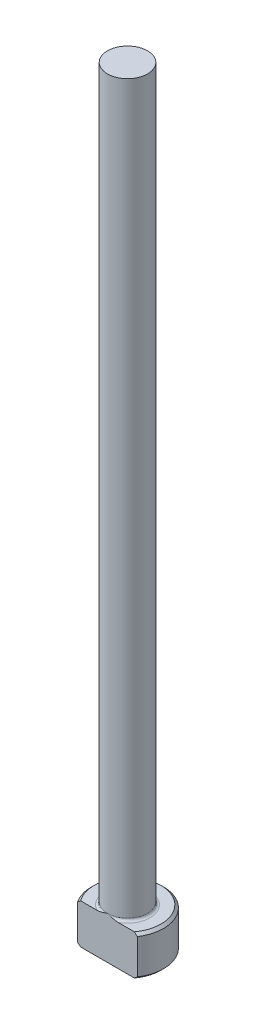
SolidWorks part; units mm, degrees
ref_plane "Front Plane" through (0, 0, 0) normal (0, 0, 1) x (1, 0, 0)
ref_plane "Top Plane" through (0, 0, 0) normal (0, 1, 0) x (1, 0, 0)
ref_plane "Right Plane" through (0, 0, 0) normal (1, 0, 0) x (0, 0, -1)
sketch "Sketch1" plane through (0, 0, 0) normal (0, 0, 1) x (1, 0, 0)
  line L0 (0, 259.9588) -> (0, -15.1925) construction
  line L1 (0, 0) -> (-3.5687, 0)
  line L2 (-3.5687, 0) -> (-3.5687, 3.9624)
  line L3 (-3.5687, 3.9624) -> (-1.9837, 3.9624)
  line L4 (-1.9837, 3.9624) -> (-1.9837, 76.2)
  line L5 (-1.9837, 76.2) -> (0, 76.2)
  line L6 (0, 76.2) -> (0, 0)
  dimension "L" = 76.2
  dimension "H" = 7.1374
  dimension "T" = 3.9624
  dimension "D" = 3.9675
revolve "Revolve1" add sketch "Sketch1" angle 360 about L0
chamfer "Chamfer1" distance 0.254 angle 45 2 edges at (0, 3.9624, 3.5687) (0, 0, 3.5687)
fillet "Fillet1" radius 0.254 1 edges at (0, 3.9624, 1.9837)
sketch "Sketch2" plane through (0, 0, 0) normal (0, 1, 0) x (1, 0, 0)
  line L0 (-2.9665, -1.9837) -> (2.9665, -1.9837)
  circle A0 centre (0, 0) radius 3.5687 construction
  arc A1 (-2.9665, -1.9837) -> (2.9665, -1.9837) centre (0, 0) ccw
  circle A3 centre (0, 0) radius 1.9837 construction
  dimension "D1" = 0
extrude "Key" cut sketch "Sketch2" along normal through all
sketch "Pocket Sketch" plane through (0, 0, 0) normal (0, 0, 1) x (1, 0, 0)
  line L0 (-3.9656, 0) -> (-3.9656, 3.9878)
  line L1 (-3.9656, 3.9878) -> (-2.9442, 3.9878)
  line L2 (-2.1822, 4.7498) -> (-2.1822, 22.225)
  line L3 (-2.1822, 22.225) -> (0, 22.225)
  line L4 (0, 22.225) -> (0, 0)
  line L5 (0, 0) -> (-3.9656, 0)
  line L6 (0, 12.6104) -> (0, -2.4989) construction
  line L7 (-3.5687, 3.7084) -> (-3.5687, 0.254) construction
  line L8 (3.3147, 3.9624) -> (-3.3147, 3.9624) construction
  line L9 (-1.9837, 76.2) -> (-1.9837, 4.2164) construction
  line L10 (-2.9442, 3.9878) -> (-2.1822, 4.7498)
  point P3 (-2.1822, 3.9878)
  dimension "D1" = 7.9311
  dimension "D2" = 0.3969
  dimension "D3" = 0.0254
  dimension "D4" = 0.1984
  dimension "D5" = 4.3644
  dimension "D6" = 22.225
